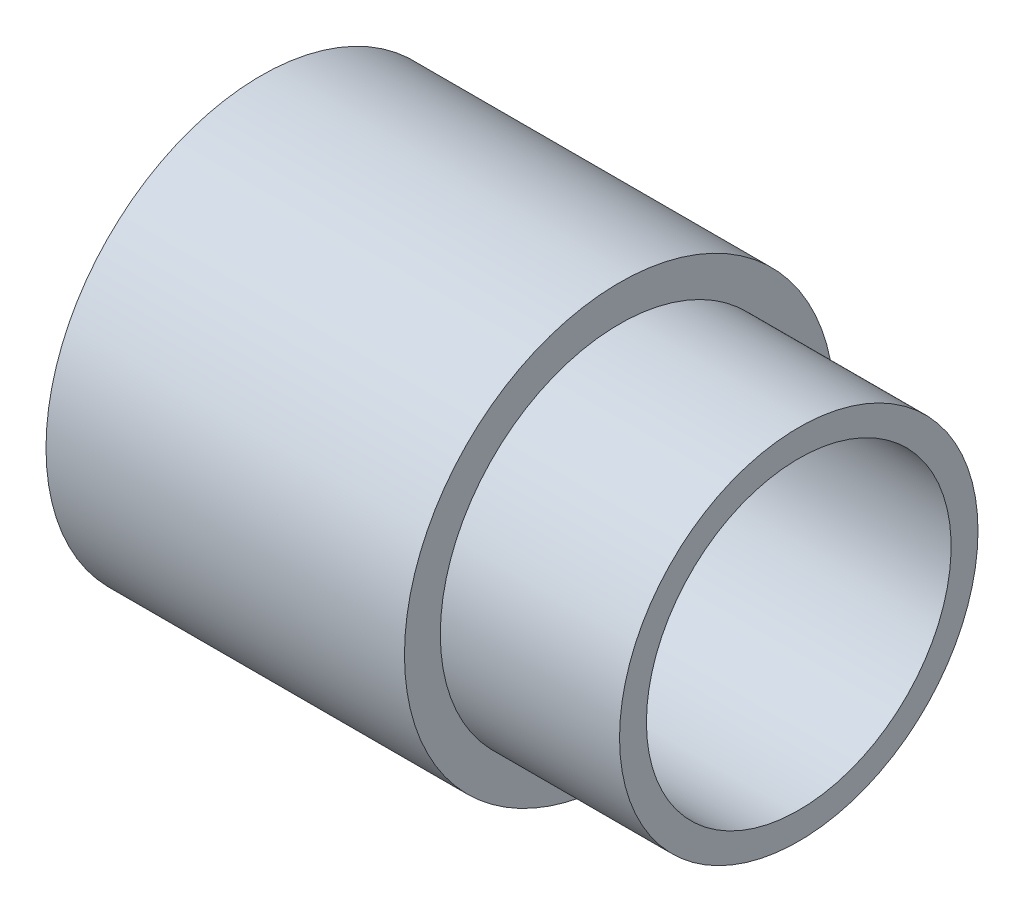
SolidWorks part; units mm, degrees
ref_plane "Front Plane" through (0, 0, 0) normal (0, 0, 1) x (1, 0, 0)
ref_plane "Top Plane" through (0, 0, 0) normal (0, 1, 0) x (1, 0, 0)
ref_plane "Right Plane" through (0, 0, 0) normal (1, 0, 0) x (0, 0, -1)
sketch "Sketch1" plane through (0, 0, 0) normal (0, 0, 1) x (1, 0, 0)
  line L0 (0, 0) -> (15, 0) construction
  line L1 (0, 4.25) -> (15, 4.25)
  line L2 (15, 4.25) -> (15, 5)
  line L3 (15, 5) -> (10, 5)
  line L4 (10, 5) -> (10, 6)
  line L5 (10, 6) -> (0, 6)
  line L6 (0, 6) -> (0, 4.25)
  dimension "D1" = 15
  dimension "D2" = 4.25
  dimension "D3" = 6
  dimension "D4" = 5
  dimension "D5" = 5
  dimension "D6" = 10
revolve "Revolve1" add sketch "Sketch1" angle 360 about L0
